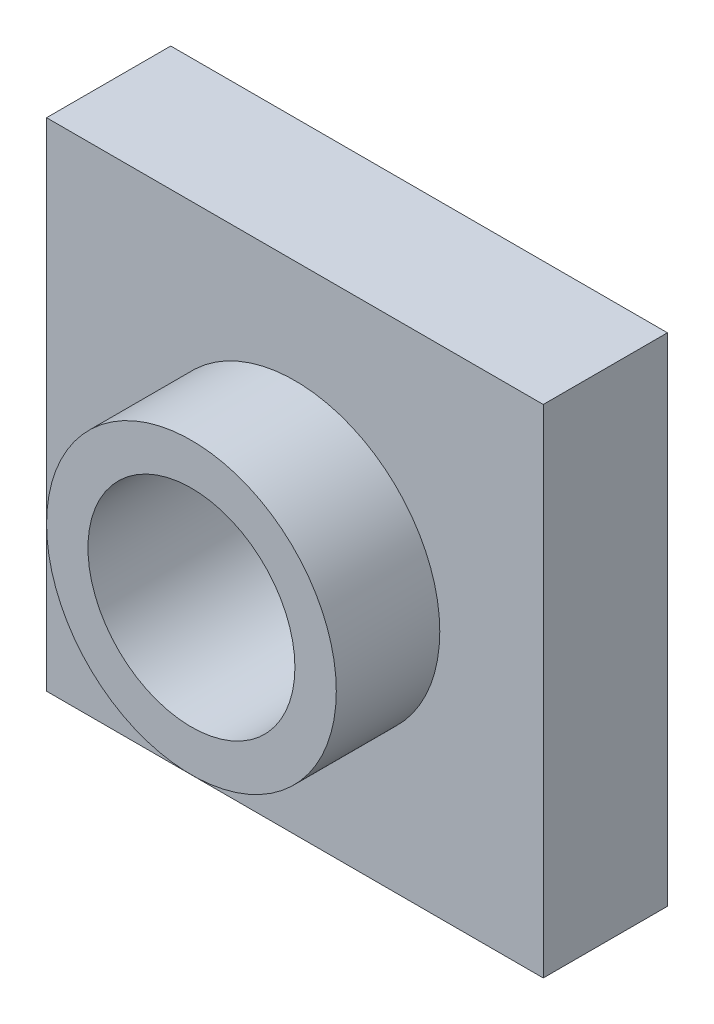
SolidWorks part; units mm, degrees
ref_plane "Front" through (0, 0, 0) normal (0, 0, 1) x (1, 0, 0)
ref_plane "Top" through (0, 0, 0) normal (0, 1, 0) x (1, 0, 0)
ref_plane "Right" through (0, 0, 0) normal (1, 0, 0) x (0, 0, -1)
sketch "Sketch1" plane through (0, 0, 0) normal (0, 0, 1) x (1, 0, 0)
  line L1 (0, 0) -> (120, 0)
  line L2 (0, 0) -> (0, 120)
  line L3 (0, 120) -> (120, 120)
  line L4 (120, 0) -> (120, 120)
  dimension "D1" = 120
  dimension "D2" = 120
extrude "Boss-Extrude1" add sketch "Sketch1" along normal blind 30
sketch "Sketch2" plane through (0, 0, 30) normal (0, 0, 1) x (1, 0, 0)
  line L0 (120, 120) -> (0, 120) construction
  line L1 (0, 120) -> (0, 0) construction
  circle A0 centre (60, 60) radius 35
  dimension "D1" = 70
  dimension "D2" = 60
  dimension "D3" = 60
extrude "Boss-Extrude2" add sketch "Sketch2" along normal blind 25
sketch "Sketch3" plane through (0, 0, 55) normal (0, 0, 1) x (1, 0, 0)
  circle A0 centre (60, 60) radius 25
  dimension "D1" = 50
extrude "Cut-Extrude1" cut sketch "Sketch3" against normal through all
